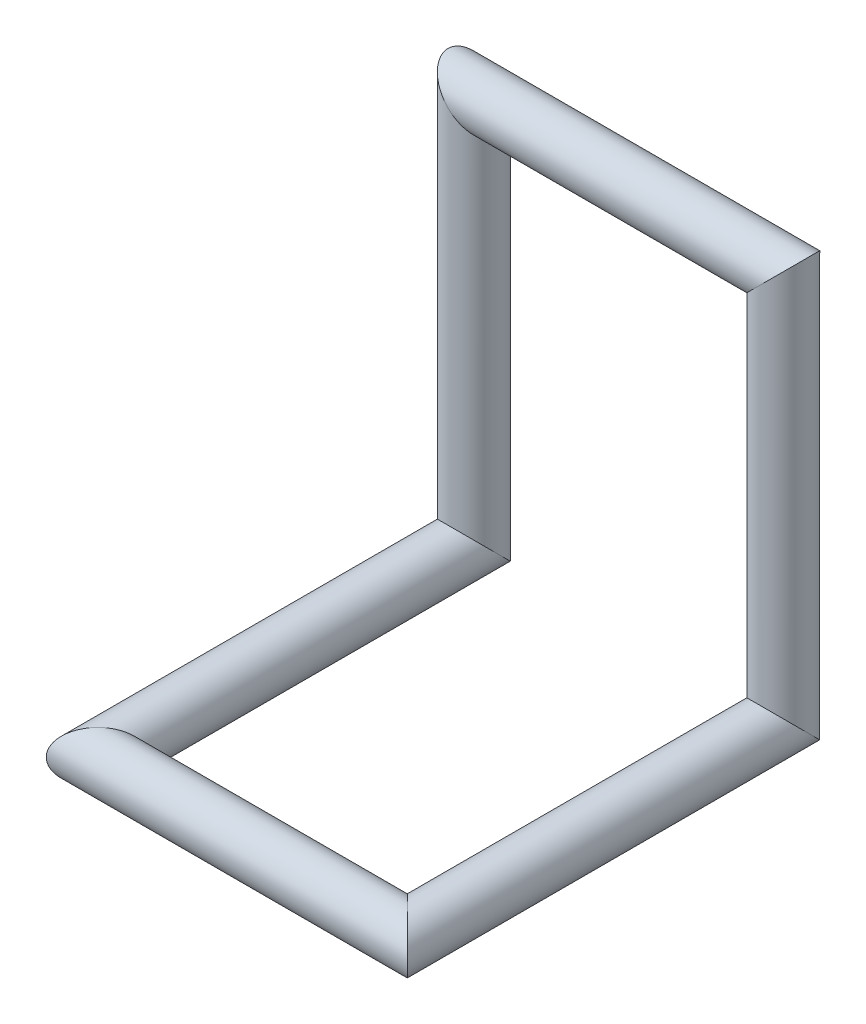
SolidWorks part; units mm, degrees
ref_plane "Front Plane" through (0, 0, 0) normal (0, 0, 1) x (1, 0, 0)
ref_plane "Top Plane" through (0, 0, 0) normal (0, 1, 0) x (1, 0, 0)
ref_plane "Right Plane" through (0, 0, 0) normal (1, 0, 0) x (0, 0, -1)
sketch "Sketch1" plane through (0, 0, 0) normal (0, 0, 1) x (1, 0, 0)
  line L2 (0, 0) -> (0, 95.331)
  line L3 (0, 95.331) -> (76.2, 95.331)
  line L4 (76.2, 0) -> (76.2, 95.331)
  dimension "D1" = 76.2
sketch "Sketch2" plane through (0, 0, 0) normal (0, 1, 0) x (1, 0, 0)
  line L2 (0, 0) -> (0, -92.5693)
  line L3 (0, -92.5693) -> (76.2, -92.5693)
  line L4 (76.2, 0) -> (76.2, -92.5693)
curve "CompCurve1"
sketch "Sketch3" plane through (0, 0, 0) normal (0, 1, 0) x (1, 0, 0)
  circle A0 centre (76.2, 0) radius 6.35
  dimension "D1" = 12.7
sweep "Sweep3" add profiles "Sketch3" path "CompCurve1"
